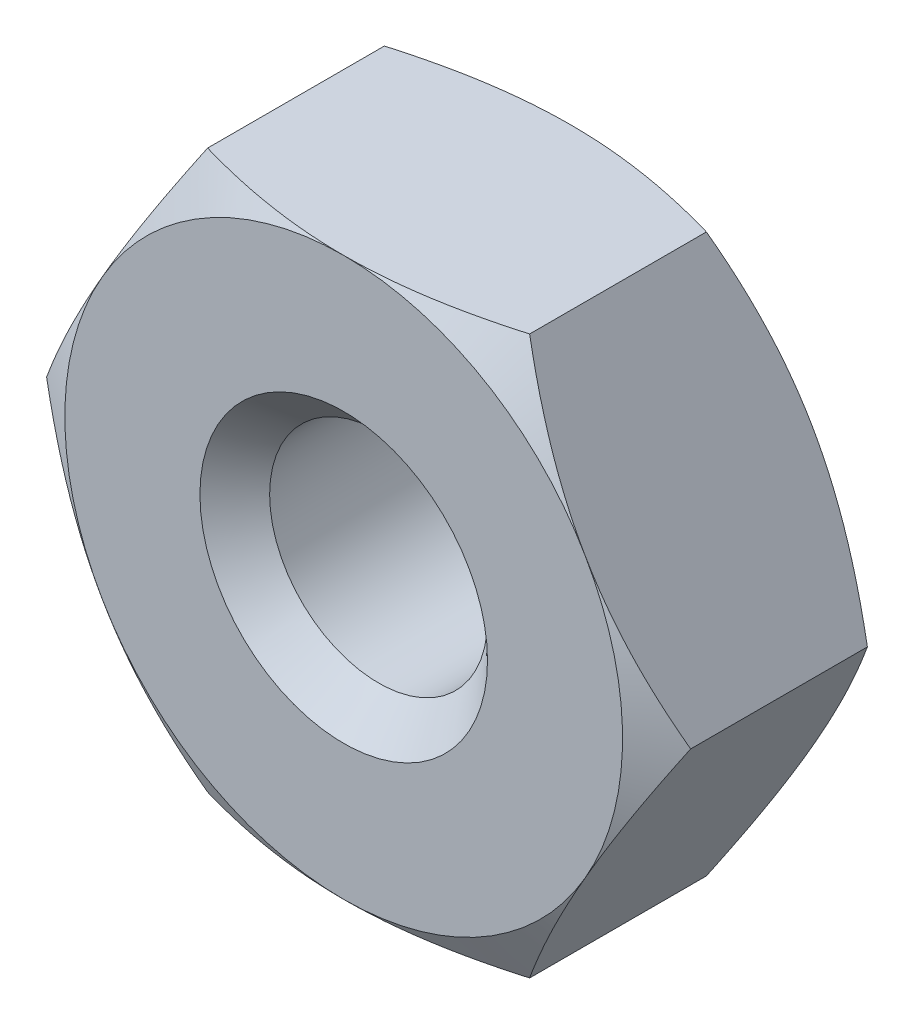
SolidWorks part; units mm, degrees
ref_plane "Ebene vorne" through (0, 0, 0) normal (0, 0, 1) x (1, 0, 0)
ref_plane "Ebene oben" through (0, 0, 0) normal (0, 1, 0) x (1, 0, 0)
ref_plane "Ebene rechts" through (0, 0, 0) normal (1, 0, 0) x (0, 0, -1)
sketch "Skizze1" plane through (0, 0, 0) normal (0, 0, 1) x (1, 0, 0)
  line L1 (1.8475, 0) -> (0.9238, 1.6)
  line L2 (0.9238, 1.6) -> (-0.9238, 1.6)
  line L3 (-0.9238, 1.6) -> (-1.8475, 0)
  line L4 (-1.8475, 0) -> (-0.9238, -1.6)
  line L5 (-0.9238, -1.6) -> (0.9238, -1.6)
  line L6 (0.9238, -1.6) -> (1.8475, 0)
  circle A0 centre (0, 0) radius 1.6 construction
  dimension "Schlüsselbreite" = 3.2
extrude "Aufsatz-Linear austragen1" add sketch "Skizze1" along normal mid plane 1.3 contours L2 L3 L4 L5 L6 L1
sketch "Skizze2" plane through (0, 0, 0.65) normal (0, 0, 1) x (1, 0, 0)
  line L0 (1.8475, 0) -> (0.9238, 1.6) construction
  circle A0 centre (0, 0) radius 1.6
extrude "Schnitt-Linear austragen1" cut sketch "Skizze2" against normal through all draft 60 flip side to cut
mirror "Spiegeln1" about plane through (0, 0, 0) normal (0, 0, 1) of "Schnitt-Linear austragen1"
hole_wizard " Gewindebohrung0" positions "Skizze3" profile "Skizze4" tap size "M1.6" standard "ISO"
sketch "Skizze3" plane through (0, 0, 0.65) normal (0, 0, 1) x (1, 0, 0)
  point P0 (0, 0)
sketch "Skizze4" plane through (0, 0, 0.65) normal (1, 0, 0) x (0, -1, 0)
  line L0 (0, 0) -> (0, 1.3)
  line L1 (0, 1.3) -> (0.625, 1.3)
  line L2 (0.625, 1.3) -> (0.625, 0)
  line L5 (0.625, 0) -> (0, 0)
  line L11 (0, -6.35) -> (0, 107.95) construction
  dimension "Bohrerdurchmesser" = 1.25
  dimension "Bohrungstiefe" = 1.3
chamfer "Fase1" distance 0.2 angle 45 2 edges at (0.625, 0, -0.65) (0.625, 0, 0.65)
